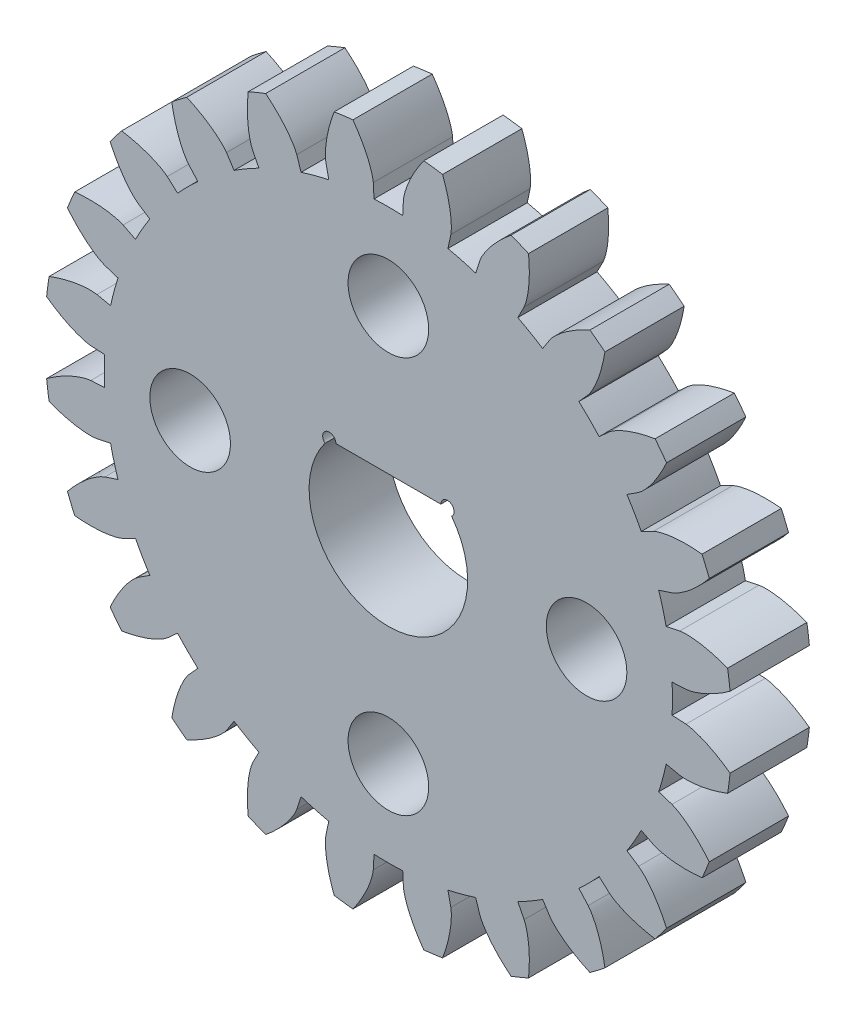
SolidWorks part; units mm, degrees
ref_plane "正面" through (0, 0, 0) normal (0, 0, 1) x (1, 0, 0)
ref_plane "平面" through (0, 0, 0) normal (0, 1, 0) x (1, 0, 0)
ref_plane "右側面" through (0, 0, 0) normal (1, 0, 0) x (0, 0, -1)
sketch "インボリュート スケッチ" plane through (0, 0, 0) normal (0, 0, 1) x (1, 0, 0)
  line L0 (-34.8106, -13.0518) -> (0.5697, -11.2619)
  line L1 (0.5697, -11.2619) -> (-0.5697, 11.2619) construction
  line L2 (0, 0) -> (0, 13) construction
  line L3 (-0.5697, 11.2619) -> (-0.5431, 10.7363)
  line L4 (0, 0) -> (0.5697, -11.2619)
  line L5 (-0.5431, 10.7363) -> (0, 10.7363)
  line L6 (0, 10.7363) -> (0, 0)
  circle A0 centre (0, 0) radius 11.2763 construction
  circle A1 centre (0, 0) radius 12 construction
  circle A2 centre (0, 0) radius 10.75 construction
  circle A3 centre (0, 0) radius 13 construction
  spline S0 degree 4 poles (-0.5697, 11.2619) (-0.574, 11.3046) (-0.5866, 11.3894) (-0.6249, 11.5484) (-0.6996, 11.7771) (-0.8595, 12.1613) (-1.1813, 12.7395) (-1.7152, 13.4541) (-2.5966, 14.3353) (-3.7723, 15.202) (-5.1872, 15.9587) (-6.8096, 16.5558) (-8.4923, 16.9475) (-10.208, 17.1468) (-12.02, 17.1664) (-14.2543, 16.9568) (-16.8688, 16.3668) (-19.7751, 15.2449) (-22.7719, 13.5148) (-25.4876, 11.3728) (-27.8885, 8.8847) (-29.6939, 6.4582) (-31.0213, 4.2351) (-31.9784, 2.3033) (-32.654, 0.7163) (-33.2393, -0.9057) (-33.7343, -2.5583) (-34.2406, -4.6529) (-34.5976, -6.7819) (-34.7866, -8.711) (-34.849, -10.3301) (-34.8576, -11.1858) (-34.8531, -11.7695) (-34.8449, -12.2259) (-34.821, -12.8723) (-34.7957, -13.354) (-34.7427, -14.1461) (-34.6848, -14.7539) (-34.6065, -15.4973) (-34.5193, -16.1547) (-34.4161, -16.8643) (-34.3018, -17.534) (-34.2052, -18.0593) (-34.1373, -18.3928) (-34.1019, -18.5662) knots 0 0 0 0 0 0.002802 0.005604 0.010661 0.015718 0.02996 0.048734 0.068727 0.096889 0.125051 0.153212 0.181374 0.209535 0.237696 0.271429 0.327752 0.384075 0.440398 0.496721 0.553044 0.609367 0.637529 0.66569 0.693852 0.722013 0.750174 0.778336 0.834659 0.86282 0.876901 0.883942 0.890982 0.900036 0.909091 0.920455 0.931818 0.943182 0.954545 0.965909 0.977273 0.988636 1 1 1 1 1 construction
  spline S1 degree 4 poles (-0.5697, 11.2619) (-0.574, 11.3046) (-0.5866, 11.3894) (-0.6249, 11.5484) (-0.6996, 11.7771) (-0.8595, 12.1613) (-1.1813, 12.7395) (-1.7152, 13.4541) (-2.5966, 14.3353) (-3.7723, 15.202) (-5.1872, 15.9587) (-6.8096, 16.5558) (-8.4923, 16.9475) (-10.208, 17.1468) (-12.02, 17.1664) (-14.2543, 16.9568) (-16.8688, 16.3668) (-19.7751, 15.2449) (-22.7719, 13.5148) (-25.4876, 11.3728) (-27.8885, 8.8847) (-29.6939, 6.4582) (-31.0213, 4.2351) (-31.9784, 2.3033) (-32.654, 0.7163) (-33.2393, -0.9057) (-33.7343, -2.5583) (-34.2406, -4.6529) (-34.5976, -6.7819) (-34.7866, -8.711) (-34.849, -10.3301) (-34.8576, -11.1858) (-34.8531, -11.7695) (-34.8449, -12.2259) (-34.8284, -12.6711) (-34.817, -12.926) (-34.8106, -13.0518) knots 0 0 0 0 0 0.002802 0.005604 0.010661 0.015718 0.02996 0.048734 0.068727 0.096889 0.125051 0.153212 0.181374 0.209535 0.237696 0.271429 0.327752 0.384075 0.440398 0.496721 0.553044 0.609367 0.637529 0.66569 0.693852 0.722013 0.750174 0.778336 0.834659 0.86282 0.876901 0.883942 0.890982 0.900036 0.909091 0.909091 0.909091 0.909091 0.909091
  point P6 (-0.7848, 11.9743)
  point P12 (0, 12)
  point P24 (0, 0)
extrude "インボリュート ボス" add sketch "インボリュート スケッチ" along normal blind 3
mirror "インボリュート ミラー" about plane through (0, 0, 3) normal (1, 0, 0)
sketch "歯先円 スケッチ" plane through (0, 0, 3) normal (0, 0, 1) x (1, 0, 0)
  circle A0 centre (0, 0) radius 37.177
  circle A1 centre (0, 0) radius 13
extrude "歯先円 カット" cut sketch "歯先円 スケッチ" against normal through all
sketch "歯分割 スケッチ" plane through (0, 0, 3) normal (0, 0, 1) x (1, 0, 0)
  line L0 (-1.6968, 12.8888) -> (0, 0)
  line L1 (0, 0) -> (1.6968, 12.8888)
  line L2 (0, 0) -> (0, 12) construction
  arc A0 (-1.6968, 12.8888) -> (1.6968, 12.8888) centre (0, 0) ccw
  circle A2 centre (0, 0) radius 12 construction
  arc A3 (-1.3415, 12.9306) -> (-5.8908, -11.5887) centre (0, 0) ccw construction
  point P9 (-1.5663, 11.8973)
  point P10 (1.5663, 11.8973)
extrude "歯分割 カット" cut sketch "歯分割 スケッチ" against normal through all
pattern_circular "歯分割 円形コピー" count 24 over 360 about axis through (0, 0, 0) along (0, 0, 1)
sketch "歯底円 スケッチ" plane through (0, 0, 3) normal (0, 0, 1) x (1, 0, 0)
  circle A0 centre (0, 0) radius 10.75
extrude "歯底円 ボス" add sketch "歯底円 スケッチ" against normal through all
sketch "軸 丸穴 スケッチ" plane through (0, 0, 3) normal (0, 0, 1) x (1, 0, 0)
  circle A0 centre (0, 0) radius 4
  dimension "D1" = 8
extrude "軸 丸穴 カット" [suppressed] cut sketch "軸 丸穴 スケッチ" against normal through all
sketch "軸 キー溝 スケッチ" plane through (0, 0, 3) normal (0, 0, 1) x (1, 0, 0)
  line L2 (-1.5, 3.7081) -> (-1.5, 5.4)
  line L3 (-1.5, 5.4) -> (1.5, 5.4)
  line L4 (1.5, 3.7081) -> (1.5, 5.4)
  arc A0 (-1.5, 3.7081) -> (1.5, 3.7081) centre (0, 0) ccw
  dimension "D1" = 8
  dimension "D2" = 3
  dimension "D3" = 5.4
extrude "軸 キー溝 カット" [suppressed] cut sketch "軸 キー溝 スケッチ" against normal through all
sketch "軸 Dカット スケッチ" plane through (0, 0, 3) normal (0, 0, 1) x (1, 0, 0)
  line L0 (-1.9861, 2) -> (1.9861, 2)
  arc A0 (-2.3948, 1.8069) -> (2.3948, 1.8069) centre (0, 0) ccw
  arc A1 (-1.9861, 2) -> (-2.3948, 1.8069) centre (-2.2361, 2) ccw
  arc A2 (2.3948, 1.8069) -> (1.9861, 2) centre (2.2361, 2) ccw
  dimension "D1" = 6
  dimension "D3" = 0.5
  dimension "D2" = 2
extrude "軸 Dカット カット" cut sketch "軸 Dカット スケッチ" against normal through all
sketch "軸 角穴 スケッチ" plane through (0, 0, 3) normal (0, 0, 1) x (1, 0, 0)
  line L0 (-5.1, 5.1) -> (5.1, 5.1)
  line L1 (-5, -5) -> (5, -5) construction
  line L2 (-5, -5) -> (-5, 5) construction
  line L3 (-5, 5) -> (5, 5) construction
  line L4 (5, -5) -> (5, 5) construction
  line L5 (-5, -5) -> (5, 5) construction
  line L6 (-5, 5) -> (5, -5) construction
  line L7 (5.1, -5.1) -> (5.1, 5.1)
  line L8 (-5.1, -5.1) -> (5.1, -5.1)
  line L9 (-5.1, -5.1) -> (-5.1, 5.1)
  point P0 (0, 0)
  dimension "D1" = 10
  dimension "D2" = 0.1
extrude "軸 角穴 カット" [suppressed] cut sketch "軸 角穴 スケッチ" against normal through all
sketch "フランジ穴 スケッチ" plane through (0, 0, 3) normal (0, 0, 1) x (1, 0, 0)
  circle A0 centre (0, 12) radius 1.6
  circle A1 centre (12, 0) radius 1.6
  circle A2 centre (0, -12) radius 1.6
  circle A3 centre (-12, 0) radius 1.6
  point P12 (0, 0)
  dimension "D2" = 3.2
  dimension "D3" = 12
  dimension "D1" = 4
extrude "フランジ穴 カット" [suppressed] cut sketch "フランジ穴 スケッチ" against normal through all
sketch "合致用スケッチ" plane through (0, 0, 3) normal (0, 0, 1) x (1, 0, 0)
  line L0 (0, 0) -> (0, 12)
  line L1 (0, 0) -> (1.5663, 11.8973)
  circle A2 centre (0, 0) radius 12
sketch "ｽｹｯﾁ1" plane through (0, 0, 3) normal (0, 0, 1) x (1, 0, 0)
  line L0 (0, 0) -> (7.5, 0) construction
  line L1 (0, 0) -> (0, -7.5) construction
  line L2 (0, 0) -> (-7.5, 0) construction
  line L3 (0, 0) -> (0, 7.5) construction
  circle A0 centre (7.5, 0) radius 1.525
  circle A1 centre (0, -7.5) radius 1.525
  circle A2 centre (-7.5, 0) radius 1.525
  circle A3 centre (0, 7.5) radius 1.525
  point P12 (0, 0)
  dimension "D1" = 3.05
  dimension "D2" = 7.5
  dimension "D3" = 4
extrude "ｶｯﾄ - 押し出し1" cut sketch "ｽｹｯﾁ1" against normal through all
equation "\"モジュール\"= 1"
equation "\"基準圧力角\"= 20"
equation "\"歯数\"= 24"
equation "\"基準円直径\"= \"歯数\" * \"モジュール\""
equation "\"基礎円直径\"= \"基準円直径\" * cos ( \"基準圧力角\" )"
equation "\"歯先円直径\"= \"基準円直径\" + 2 * \"モジュール\""
equation "\"歯底円直径\"= \"基準円直径\" - 2.5 * \"モジュール\""
equation "\"D1@インボリュート スケッチ\" = \"基礎円直径\""
equation "\"D2@インボリュート スケッチ\" = \"基準円直径\""
equation "\"D3@インボリュート スケッチ\" = \"歯底円直径\""
equation "\"D4@インボリュート スケッチ\" = \"歯先円直径\""
equation "\"D5@インボリュート スケッチ\" = Pi * \"モジュール\" / 4"
equation "\"D1@歯先円 スケッチ\" = \"歯先円直径\""
equation "\"D1@歯分割 スケッチ\" = \"基準円直径\""
equation "\"D2@歯分割 スケッチ\" = PI * \"モジュール\""
equation "\"D1@歯分割 円形コピー\" = \"歯数\""
equation "\"D1@歯底円 スケッチ\" = \"歯底円直径\""
equation "\"板厚\"= 3"
equation "\"D1@インボリュート ボス\"=\"板厚\""
equation "\"D1@合致用スケッチ\" = \"基準円直径\""
equation "\"D2@合致用スケッチ\"=180/\"歯数\""
